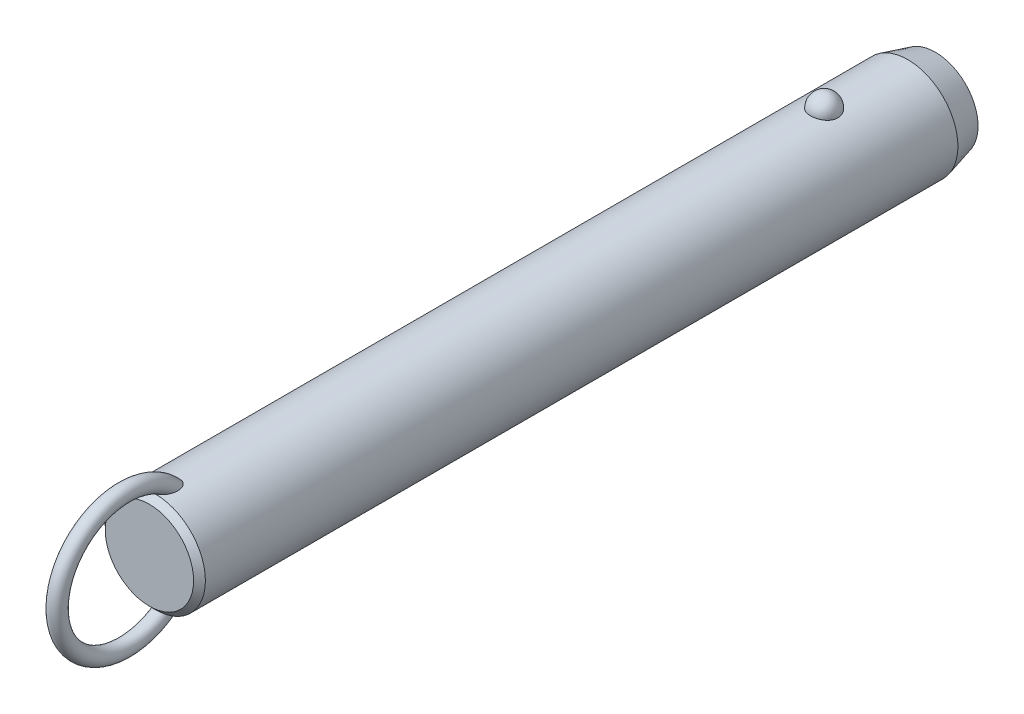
SolidWorks part; units mm, degrees
ref_plane "Front Plane" through (0, 0, 0) normal (0, 0, 1) x (1, 0, 0)
ref_plane "Top Plane" through (0, 0, 0) normal (0, 1, 0) x (1, 0, 0)
ref_plane "Right Plane" through (0, 0, 0) normal (1, 0, 0) x (0, 0, -1)
sketch "Sketch2" plane through (0, 0, 0) normal (0, 0, 1) x (1, 0, 0)
  circle A0 centre (0, 0) radius 12.7
  point P3 (0, 12.7)
  dimension "D1" = 25.4
extrude "Boss-Extrude1" add sketch "Sketch2" along normal blind 154.9
sketch "Sketch3" plane through (0, 0, 0) normal (0, 0, -1) x (-1, 0, 0)
  circle A0 centre (0, 0) radius 12.7
  dimension "D1" = 25.4
extrude "Boss-Extrude2" add sketch "Sketch3" along normal blind 31.7
chamfer "Chamfer1" distance 7 angle 15 1 edges at (-12.7, 0, -31.7)
sketch "Sketch12" plane through (0, 0, 0) normal (1, 0, 0) x (0, 0, -1)
  line L0 (-154.9, 12.7) -> (-154.9, -12.7) construction
  point P0 (-154.9, 0)
sketch "Sketch13" plane through (0, 0, 0) normal (1, 0, 0) x (0, 0, -1)
  circle A0 centre (-173.95, 0) radius 19.05
  point P2 (-154.9, 0)
  dimension "D1" = 38.1
sketch "Sketch14" plane through (0, 0, 0) normal (0, 1, 0) x (1, 0, 0)
  circle A0 centre (0, -156.9) radius 2
  point P2 (0, -154.9)
  dimension "D1" = 4
sweep "Sweep1" add profiles "Sketch14" path "Sketch13"
sketch "Sketch15" plane through (0, 0, 154.9) normal (0, 0, 1) x (1, 0, 0)
  circle A0 centre (0, 0) radius 12.7
  dimension "D1" = 25.4
extrude "Boss-Extrude3" add sketch "Sketch15" along normal blind 12.7
chamfer "Chamfer2" distance 1.5 angle 45 1 edges at (12.7, 0, 167.6)
sketch "Sketch18" plane through (0, 0, 0) normal (1, 0, 0) x (0, 0, -1)
  line L0 (24.7, 12.7) -> (-159.751, 12.7) construction
  line L1 (3.5, 16.2) -> (3.5, 9.2)
  line L2 (-159.751, -12.7) -> (24.7, -12.7) construction
  arc A0 (3.5, 16.2) -> (3.5, 9.2) centre (3.5, 12.7) ccw
  point P4 (0, 12.7)
  dimension "D1" = 28.9
revolve "Revolve1" add sketch "Sketch18" angle 360 about L1
